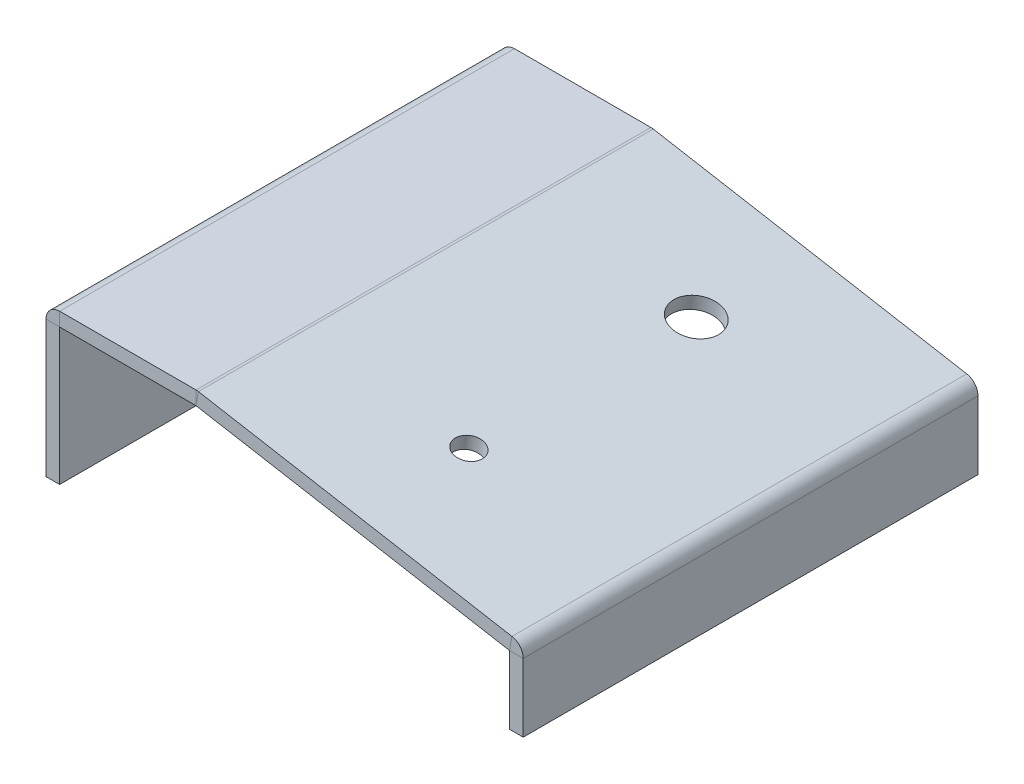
SolidWorks part; units mm, degrees
ref_plane "Front Plane" through (0, 0, 0) normal (0, 0, 1) x (1, 0, 0)
ref_plane "Top Plane" through (0, 0, 0) normal (0, 1, 0) x (1, 0, 0)
ref_plane "Right Plane" through (0, 0, 0) normal (1, 0, 0) x (0, 0, -1)
sketch "Sketch1" plane through (0, 0, 0) normal (0, 1, 0) x (1, 0, 0)
  line L0 (0, 50) -> (145, 50) construction
  line L1 (0, 0) -> (145, 0)
  line L2 (0, 0) -> (0, 100)
  line L3 (0, 100) -> (145, 100)
  line L4 (145, 0) -> (145, 100)
  line L5 (95, 100) -> (95, 0) construction
  circle A0 centre (7, 50) radius 2.25
  circle A1 centre (95, 75) radius 5
  circle A2 centre (95, 25) radius 3
  dimension "D3" = 7
  dimension "D4" = 4.5
  dimension "D6" = 10
  dimension "D7" = 6
  dimension "D9" = 25
  dimension "D1" = 100
  dimension "D2" = 145
  dimension "D5" = 50
  dimension "D8" = 25
sheet metal parameters "Sheet-Metal1" thickness 3 parameters "D1"=0.0001
base flange "Base-Flange1" sketch "Sketch1" thickness 3 reverse thickness direction yes parameters "D1"=0.0001
sketch "Sketch3" plane through (0, 3, 0) normal (0, 1, 0) x (1, 0, 0)
  line L0 (30, 100) -> (30, 0)
  line L1 (145, 100) -> (0, 100) construction
  line L2 (0, 0) -> (145, 0) construction
  line L3 (0, 100) -> (0, 0) construction
  dimension "D1" = 30
sketched bend "Sketched Bend1" parameters "D1"=0.0001
bend "SketchBend1" bend radius 0.0001 bend angle 90 parameters "D5"=1
sketch "Sketch4" plane through (0, 3, 0) normal (0, 1, 0) x (1, 0, 0)
  line L0 (60, 100) -> (60, 2.0064)
  line L1 (145, 100) -> (30, 100) construction
  line L2 (145, 0) -> (145, 100) construction
  dimension "D1" = 85
sketched bend "Sketched Bend3" parameters "D1"=0.001
bend "SketchBend3" bend radius 0.001 bend angle 10 parameters "D5"=2
sketch "Sketch5" plane through (2.3302, 13.215, 0) normal (0.1736, 0.9848, 0) x (0.9848, -0.1736, 0)
  line L0 (129.0885, 100) -> (129.0885, 2.0913)
  line L1 (144.0885, 100) -> (59.0886, 100) construction
  line L2 (144.0885, 0) -> (144.0885, 100) construction
  dimension "D1" = 15
sketched bend "Sketched Bend4" parameters "D1"=0.001
bend "SketchBend4" bend radius 0.0001 bend angle 80 parameters "D5"=3
flat pattern "Flat-Pattern1"
sketch "Bend-Lines1" plane through (0, 0, 0) normal (0, 1, 0) x (-1, 0, 0)
bend of the flat pattern "Flatten-<SketchBend1>1"
bend of the flat pattern "Flatten-<SketchBend3>1"
bend of the flat pattern "Flatten-<SketchBend4>1"
